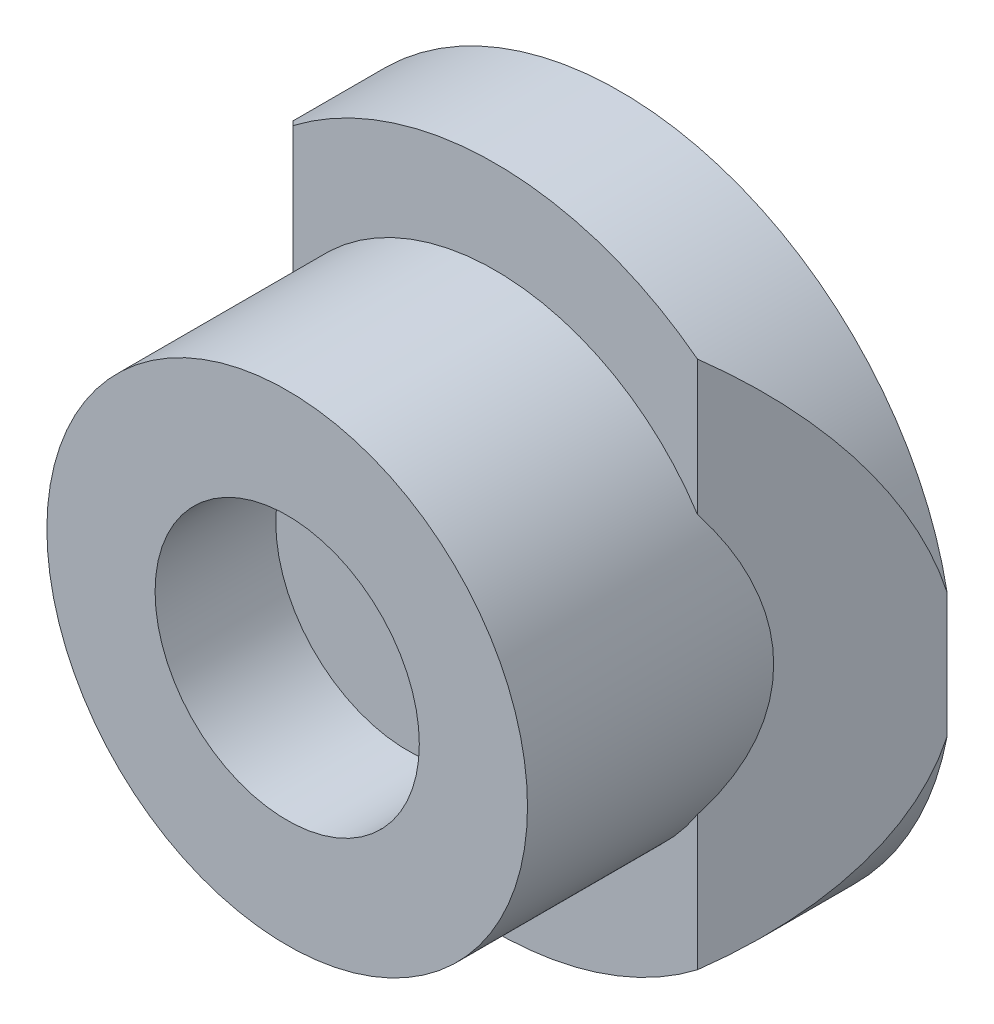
SolidWorks part; units mm, degrees
ref_plane "Front Plane" through (0, 0, 0) normal (0, 0, 1) x (1, 0, 0)
ref_plane "Top Plane" through (0, 0, 0) normal (0, 1, 0) x (1, 0, 0)
ref_plane "Right Plane" through (0, 0, 0) normal (1, 0, 0) x (0, 0, -1)
sketch "Sketch2" plane through (0, 0, 0) normal (0, 0, 1) x (1, 0, 0)
  circle A0 centre (0, 0) radius 5.775
  dimension "D1" = 11.55
extrude "Boss-Extrude1" add sketch "Sketch2" along normal blind 5
sketch "Sketch3" plane through (0, 0, 0) normal (0, 0, 1) x (1, 0, 0)
  circle A0 centre (0, 0) radius 8
  dimension "D1" = 16
extrude "Boss-Extrude2" add sketch "Sketch3" against normal blind 3
sketch "Sketch4" plane through (0, 0, 5) normal (0, 0, 1) x (1, 0, 0)
  circle A0 centre (0, 0) radius 3.175
  dimension "D1" = 6.35
extrude "Cut-Extrude1" cut sketch "Sketch4" against normal blind 2.9
sketch "Sketch5" plane through (0, 0, 0) normal (0, 1, 0) x (1, 0, 0)
  line L1 (-5, 0) -> (0, 0) construction
  line L5 (0, 0) -> (5, 0) construction
  line L8 (-8, 3) -> (-8, 0)
  line L9 (-8, 0) -> (-5, 0)
  line L10 (-5.775, 0) -> (5.775, 0) construction
  line L11 (-5, 0) -> (-8, 3) construction
  line L13 (8, 3) -> (8, 0)
  line L14 (8, 0) -> (5, 0)
  line L15 (5, 0) -> (8, 3) construction
  line L16 (8, 3) -> (7.8586, 3)
  line L17 (8, 3) -> (-8, 3) construction
  line L18 (7.8586, 3) -> (4.8586, 0)
  line L19 (4.8586, 0) -> (5, 0)
  line L20 (-5, 0) -> (-4.8586, 0)
  line L21 (-4.8586, 0) -> (-7.8586, 3)
  line L22 (-7.8586, 3) -> (-8, 3)
  dimension "D1" = 135
  dimension "D2" = 0.1
  dimension "D3" = 0.1
extrude "Cut-Extrude2" cut sketch "Sketch5" against normal through all both and the other way through all
sketch "Sketch7" plane through (0, 0, 0) normal (0, 0, 1) x (1, 0, 0)
  circle A0 centre (0, 0) radius 5.775
extrude "Boss-Extrude3" add sketch "Sketch7" against normal blind 2
